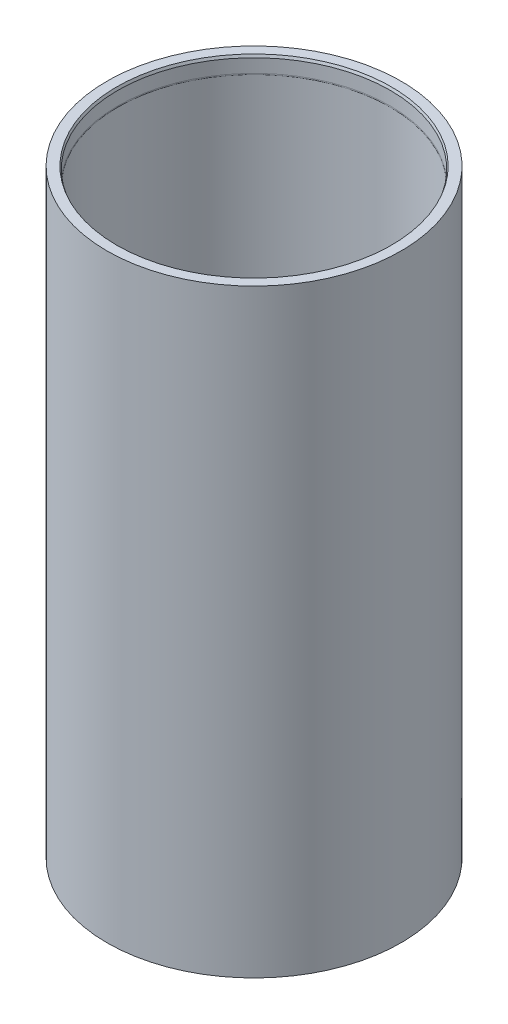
SolidWorks part; units mm, degrees
ref_plane "Front Plane" through (0, 0, 0) normal (0, 0, 1) x (1, 0, 0)
ref_plane "Top Plane" through (0, 0, 0) normal (0, 1, 0) x (1, 0, 0)
ref_plane "Right Plane" through (0, 0, 0) normal (1, 0, 0) x (0, 0, -1)
sketch "Sketch2" plane through (0, 0, 0) normal (0, 1, 0) x (1, 0, 0)
  circle A0 centre (0, 0) radius 137.16
  circle A1 centre (0, 0) radius 127
  dimension "D1" = 274.32
  dimension "D2" = 254
extrude "Boss-Extrude1" add sketch "Sketch2" along normal mid plane 558.8
sketch "Sketch3" plane through (0, -279.4, 0) normal (0, -1, 0) x (1, 0, 0)
  circle A0 centre (0, 0) radius 127.127
  dimension "D1" = 254.254
extrude "Cut-Extrude1" cut sketch "Sketch3" against normal blind 15.875
mirror "Mirror6" about plane through (0, 0, 0) normal (0, 1, 0) of "Cut-Extrude1"
fillet "Fillet1" radius 2.54 2 edges at (0, -263.525, -127.127) (0, 263.525, -127.127)
chamfer "Chamfer2" distance 0.889 angle 70 2 edges at (0, -279.4, -127.127) (0, 279.4, -127.127)
sketch "Sketch6" plane through (0, 279.4, 0) normal (0, 1, 0) x (1, 0, 0)
  line L0 (-239.1214, 0) -> (0, 0)
  line L1 (0, 0) -> (0, 239.1214)
  arc A0 (-239.1214, 0) -> (0, 239.1214) centre (0, 0) ccw
extrude "FEA Cut" [suppressed] cut sketch "Sketch6" against normal through all
sketch "Sketch7" plane through (0, 279.4, 0) normal (0, 1, 0) x (1, 0, 0)
  circle A0 centre (0, 0) radius 215.6863
extrude "FEA Cut2" [suppressed] cut sketch "Sketch7" against normal blind 279.4
